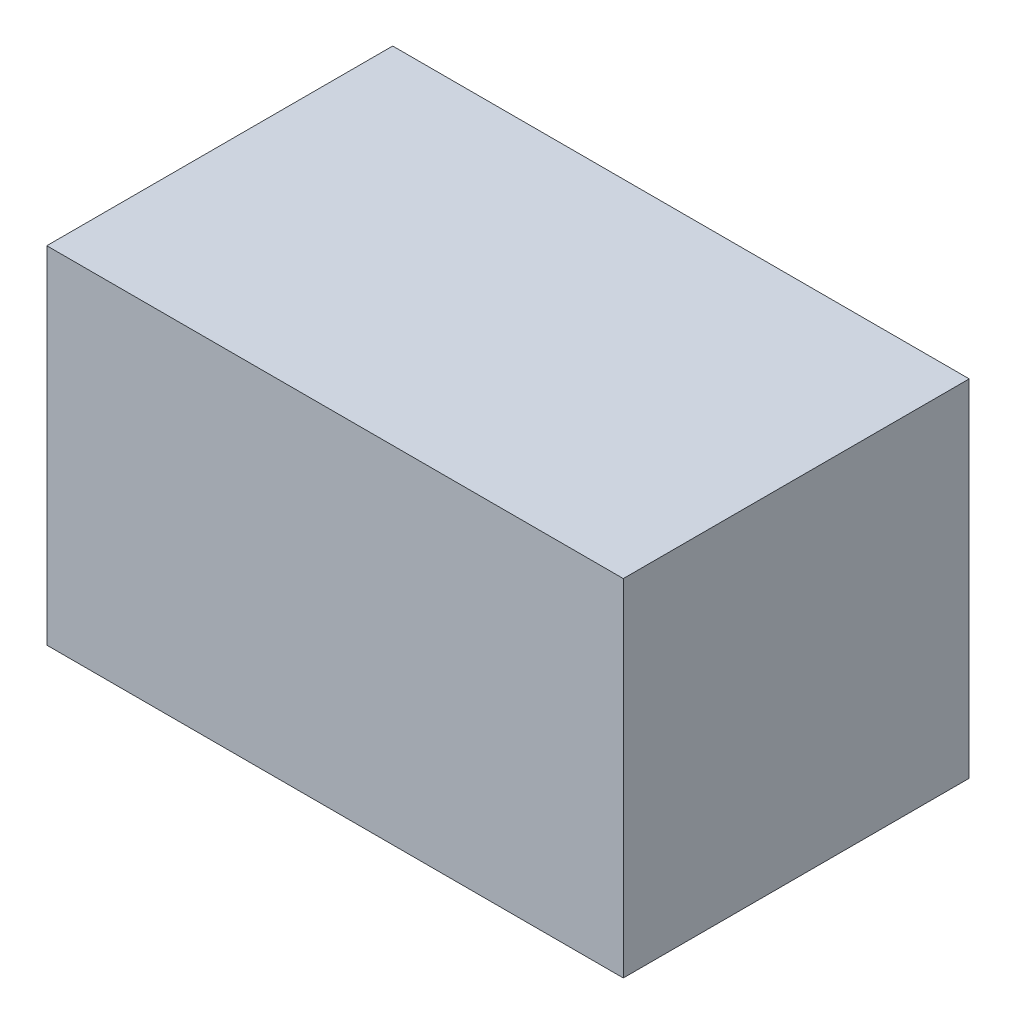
SolidWorks part; units mm, degrees
ref_plane "正面" through (0, 0, 0) normal (0, 0, 1) x (1, 0, 0)
ref_plane "平面" through (0, 0, 0) normal (0, 1, 0) x (1, 0, 0)
ref_plane "右側面" through (0, 0, 0) normal (1, 0, 0) x (0, 0, -1)
sketch "ｽｹｯﾁ1" plane through (0, 0, 0) normal (0, 1, 0) x (1, 0, 0)
  line L1 (-25, -15) -> (25, -15)
  line L2 (-25, -15) -> (-25, 15)
  line L3 (-25, 15) -> (25, 15)
  line L4 (25, -15) -> (25, 15)
  line L5 (-25, -15) -> (25, 15) construction
  line L6 (-25, 15) -> (25, -15) construction
  point P0 (0, 0)
  dimension "D1" = 50
  dimension "D2" = 30
extrude "ﾎﾞｽ - 押し出し1" add sketch "ｽｹｯﾁ1" along normal mid plane 30
